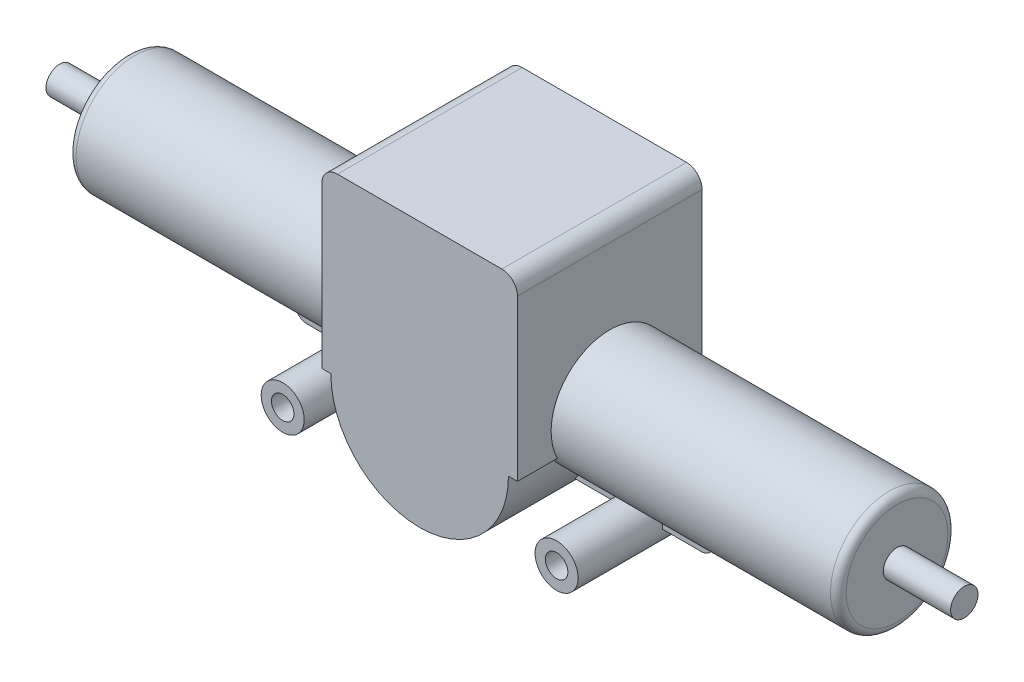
SolidWorks part; units mm, degrees
ref_plane "Front" through (0, 0, 0) normal (0, 0, 1) x (1, 0, 0)
ref_plane "Top" through (0, 0, 0) normal (0, 1, 0) x (1, 0, 0)
ref_plane "Right" through (0, 0, 0) normal (1, 0, 0) x (0, 0, -1)
sketch "Sketch1" plane through (0, 0, 0) normal (0, 0, 1) x (1, 0, 0)
  line L0 (14.4145, -4.2882) -> (15.875, -4.2882)
  line L1 (-13.335, 24.2868) -> (13.335, 24.2868)
  line L2 (-15.875, 21.7468) -> (-15.875, -4.2882)
  line L3 (-15.875, -4.2882) -> (-14.4145, -4.2882)
  line L4 (15.875, 21.7468) -> (15.875, -4.2882)
  arc A0 (-14.4145, -4.2882) -> (14.4145, -4.2882) centre (0, -4.2882) ccw
  arc A1 (13.335, 24.2868) -> (15.875, 21.7468) centre (13.335, 21.7468) cw
  arc A2 (-13.335, 24.2868) -> (-15.875, 21.7468) centre (-13.335, 21.7468) ccw
  point P6 (0, 24.2868)
  point P12 (15.875, 24.2868)
  point P15 (-15.875, 24.2868)
  dimension "D1" = 28.829
  dimension "D4" = 2.54
  dimension "D2" = 31.75
  dimension "D3" = 28.575
extrude "Boss-Extrude1" add sketch "Sketch1" along normal mid plane 29.972
sketch "Sketch2" plane through (0, 0, 0) normal (1, 0, 0) x (0, 0, -1)
  circle A0 centre (0, 0) radius 9.525
  dimension "D1" = 19.05
extrude "Boss-Extrude2" add sketch "Sketch2" along normal mid plane 124.968
fillet "Fillet1" radius 1.27 2 edges at (62.484, 0, -9.525) (-62.484, 0, -9.525)
sketch "Sketch3" plane through (0, 0, 0) normal (0, 0, 1) x (1, 0, 0)
  line L1 (-33.909, -7.1197) -> (33.909, -7.1197)
  line L2 (-33.909, -7.1197) -> (-33.909, -11.049)
  line L3 (-32.004, -12.954) -> (-25.7175, -12.954)
  line L4 (33.909, -7.1197) -> (33.909, -11.049)
  line L5 (0, 0) -> (0, -22.9855) construction
  line L6 (-22.225, -16.4465) -> (22.225, -16.4465) construction
  line L7 (-18.7325, -12.954) -> (18.7325, -12.954)
  line L8 (25.7175, -12.954) -> (32.004, -12.954)
  arc A0 (-25.7175, -12.954) -> (-18.7325, -12.954) centre (-22.225, -12.954) ccw
  arc A1 (18.7325, -12.954) -> (25.7175, -12.954) centre (22.225, -12.954) ccw
  arc A2 (32.004, -12.954) -> (33.909, -11.049) centre (32.004, -11.049) ccw
  arc A3 (-33.909, -11.049) -> (-32.004, -12.954) centre (-32.004, -11.049) ccw
  point P12 (0, -16.4465)
  point P20 (33.909, -12.954)
  point P23 (-33.909, -12.954)
  point P24 (0, -7.1197)
  dimension "D5" = 1.905
  dimension "D1" = 67.818
  dimension "D2" = 12.954
  dimension "D3" = 44.45
  dimension "D4" = 6.985
extrude "Boss-Extrude6" add sketch "Sketch3" along normal mid plane 2.54 contours L3 A0 L7 A1 L8 A2 L4 L1 L2 A3
hole_wizard "#6 Clearance Hole1" positions "Sketch4" profile "Sketch5" hole size "#6" standard "ANSI Inch"
sketch "Sketch4" plane through (0, 0, 1.27) normal (0, 0, 1) x (1, 0, 0)
  point P0 (-22.225, -12.954)
  point P3 (22.225, -12.954)
sketch "Sketch5" plane through (-22.225, -12.954, 1.27) normal (1, 0, 0) x (0, -1, 0)
  line L0 (0, 0) -> (0, 2.54)
  line L1 (0, 2.54) -> (1.8288, 2.54)
  line L2 (1.8288, 2.54) -> (1.8288, 0)
  line L5 (1.8288, 0) -> (0, 0)
  line L11 (0, -6.35) -> (0, 107.95) construction
  dimension "Thru Hole Dia." = 3.6576
  dimension "Thru Hole Depth" = 2.54
sketch "Sketch6" plane through (0, 0, 1.27) normal (0, 0, 1) x (1, 0, 0)
  circle A0 centre (-22.225, -12.954) radius 3.4925
  circle A1 centre (22.225, -12.954) radius 3.4925
  circle A2 centre (-22.225, -12.954) radius 1.8288 construction
  circle A3 centre (22.225, -12.954) radius 1.8288 construction
  circle A4 centre (-22.225, -12.954) radius 1.8288
  circle A5 centre (22.225, -12.954) radius 1.8288
  arc A6 (-25.7175, -12.954) -> (-18.7325, -12.954) centre (-22.225, -12.954) ccw construction
extrude "Boss-Extrude7" add sketch "Sketch6" along normal up to surface (13.716 mm away)
sketch "Sketch7" plane through (-62.484, 0, 0) normal (-1, 0, 0) x (0, 0, 1)
  circle A0 centre (0, 0) radius 2.2225
  dimension "D1" = 4.445
extrude "Boss-Extrude8" add sketch "Sketch7" along normal offset from surface (10.922 mm away) 73.406
mirror "Mirror2" about plane through (0, 0, 0) normal (1, 0, 0) of "Boss-Extrude8"
